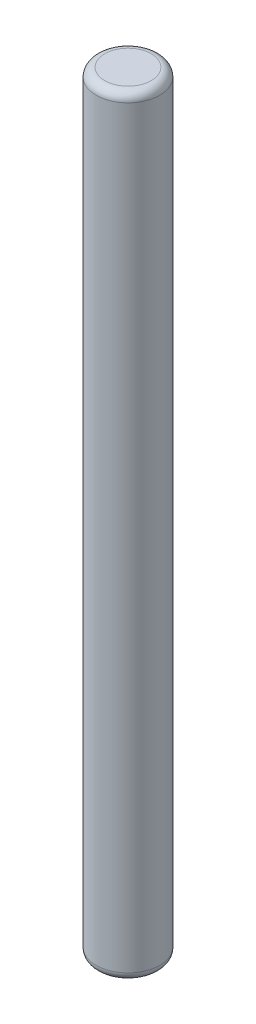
SolidWorks part; units mm, degrees
ref_plane "Спереди" through (0, 0, 0) normal (0, 0, 1) x (1, 0, 0)
ref_plane "Сверху" through (0, 0, 0) normal (0, 1, 0) x (1, 0, 0)
ref_plane "Справа" through (0, 0, 0) normal (1, 0, 0) x (0, 0, -1)
sketch "Эскиз1" plane through (0, 0, 0) normal (0, 1, 0) x (1, 0, 0)
  circle A0 centre (0, 0) radius 0.375
  dimension "D1" = 0.75
extrude "Бобышка-Вытянуть1" add sketch "Эскиз1" along normal blind 9.1
fillet "Скругление1" radius 0.1 2 edges at (0, 0, 0.375) (0, 9.1, 0.375)
